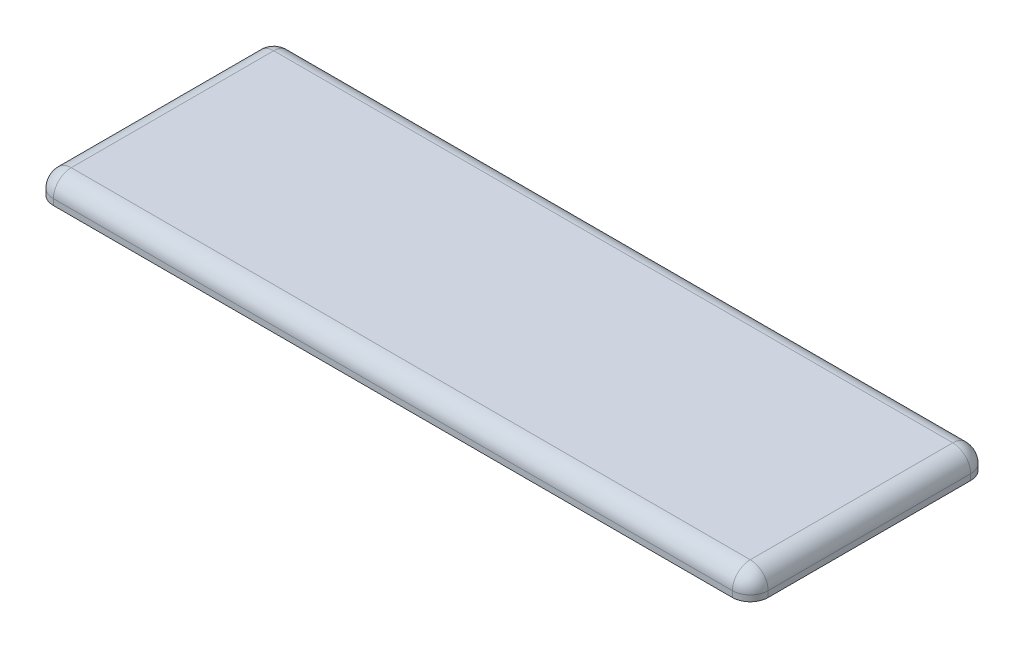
SolidWorks part; units mm, degrees
other "<10000-01-0000-00_abdeckkappe_120x40>-<Schnitt-Linear austragen2>"
ref_plane "Ebene vorne" through (0, 0, 0) normal (0, 0, 1) x (1, 0, 0)
ref_plane "Ebene oben" through (0, 0, 0) normal (0, 1, 0) x (1, 0, 0)
ref_plane "Ebene rechts" through (0, 0, 0) normal (1, 0, 0) x (0, 0, -1)
inserted part "10000-01-0000-00_abdeckkappe_120x40"
other "Fläche verschieben4" parameters "D1"=90
